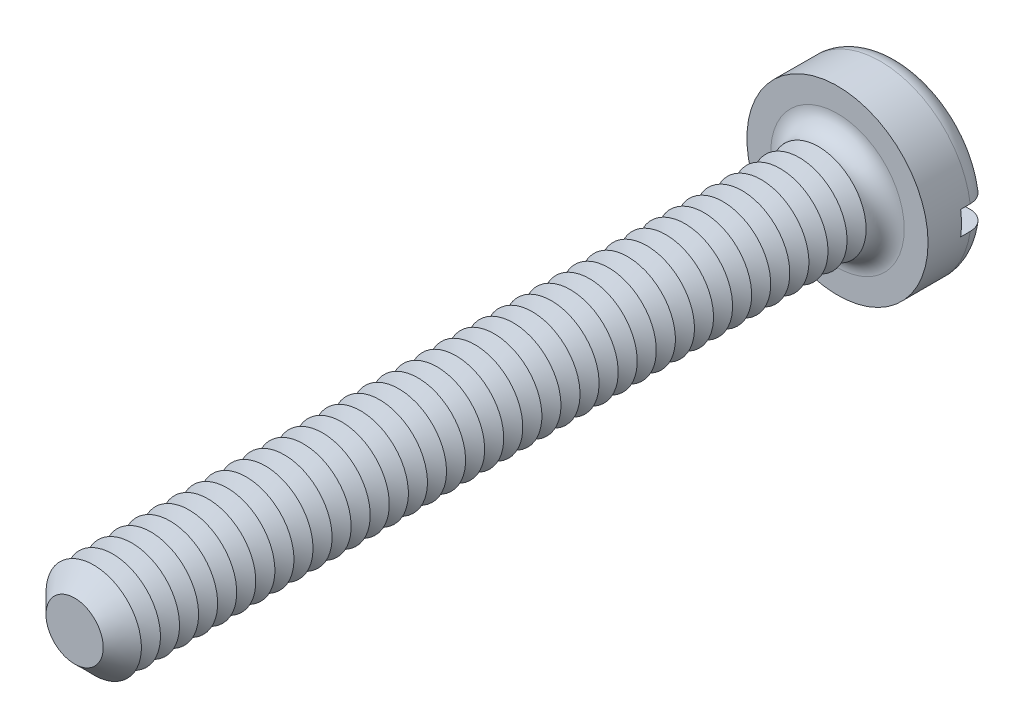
SolidWorks part; units mm, degrees
ref_plane "Front Plane" through (0, 0, 0) normal (0, 0, 1) x (1, 0, 0)
ref_plane "Top Plane" through (0, 0, 0) normal (0, 1, 0) x (1, 0, 0)
ref_plane "Right Plane" through (0, 0, 0) normal (1, 0, 0) x (0, 0, -1)
sketch "Sketch3" plane through (0, 0, 0) normal (0, 0, 1) x (1, 0, 0)
  circle A0 centre (0, 0) radius 1.9
  dimension "D1" = 3.8
extrude "Boss-Extrude2" add sketch "Sketch3" against normal blind 1.3
sketch "Sketch4" plane through (0, 0, 0) normal (0, 0, 1) x (1, 0, 0)
  circle A0 centre (0, 0) radius 1
  dimension "D1" = 2
extrude "Boss-Extrude3" add sketch "Sketch4" along normal blind 16
fillet "Fillet1" radius 0.4 2 edges at (1.9, 0, -1.3) (1, 0, 0)
chamfer "Chamfer1" distance 0.4 angle 45 1 edges at (1, 0, 16)
sketch "Sketch5" plane through (0, 0, 0) normal (1, 0, 0) x (0, 0, -1)
  line L0 (1.6944, 0) -> (-7.6738, 0) construction
sketch "Sketch6" plane through (0, 0, 0) normal (1, 0, 0) x (0, 0, -1)
  line L0 (-0.4, 1) -> (-0.6, 0.6536)
  line L1 (-0.6, 0.6536) -> (-0.8, 1)
  line L2 (-0.4, 1) -> (-15.6, 1) construction
  line L3 (-0.8, 1) -> (-0.4, 1)
  dimension "D1" = 0.4
revolve "Cut-Revolve1" cut sketch "Sketch6" angle 360 about L0
pattern_linear "LPattern1" count 38 spacing 0.4 along (0, 0, 1) of "Cut-Revolve1"
sketch "Sketch8" plane through (0, 0, -1.3) normal (0, 0, -1) x (-1, 0, 0)
  line L1 (1.9, -0.25) -> (-1.9, -0.25)
  line L2 (1.9, -0.25) -> (1.9, 0.25)
  line L3 (1.9, 0.25) -> (-1.9, 0.25)
  line L4 (-1.9, -0.25) -> (-1.9, 0.25)
  line L5 (1.9, -0.25) -> (-1.9, 0.25) construction
  line L6 (1.9, 0.25) -> (-1.9, -0.25) construction
  point P0 (0, 0)
  dimension "D1" = 3.8
  dimension "D2" = 0.5
extrude "Cut-Extrude1" cut sketch "Sketch8" against normal blind 0.6
